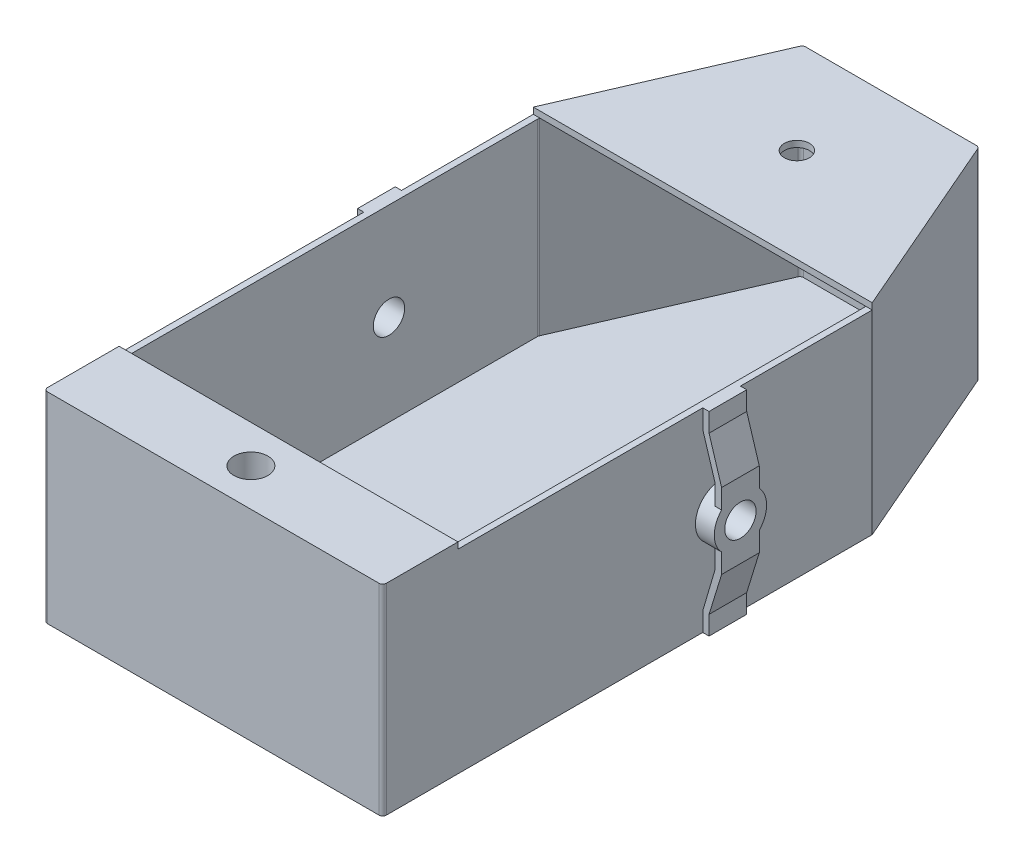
SolidWorks part; units mm, degrees
ref_plane "Front Plane" through (0, 0, 0) normal (0, 0, 1) x (1, 0, 0)
ref_plane "Top Plane" through (0, 0, 0) normal (0, 1, 0) x (1, 0, 0)
ref_plane "Right Plane" through (0, 0, 0) normal (1, 0, 0) x (0, 0, -1)
sketch "Sketch1" plane through (0, 0, 0) normal (0, 1, 0) x (1, 0, 0)
  line L0 (-135, 270) -> (-135, 120) construction
  line L1 (135, -270) -> (-135, -270)
  line L2 (135, -270) -> (135, 120)
  line L3 (70, 270) -> (-70, 270)
  line L4 (-135, -270) -> (-135, 120)
  line L5 (135, -270) -> (-135, 270) construction
  line L6 (135, 270) -> (-135, -270) construction
  line L7 (-135, 120) -> (135, 120) construction
  line L8 (-135, 120) -> (-70, 270)
  line L9 (135, 120) -> (70, 270)
  point P0 (0, 0)
  dimension "D1" = 540
  dimension "D2" = 270
  dimension "D3" = 150
  dimension "D4" = 65
  dimension "D5" = 65
extrude "Boss-Extrude5" add sketch "Sketch1" along normal blind 5
sketch "Sketch3" plane through (0, 5, 0) normal (0, 1, 0) x (1, 0, 0)
  line L0 (-70, 270) -> (-135, 120) construction
  line L1 (-135, 120) -> (-135, -270) construction
  line L2 (-135, -270) -> (135, -270) construction
  line L3 (135, -270) -> (135, 120) construction
  line L4 (135, 120) -> (70, 270) construction
  line L5 (70, 270) -> (-70, 270) construction
  line L6 (-70, 270) -> (-135, 120)
  line L7 (-135, 120) -> (-135, -270)
  line L8 (-135, -270) -> (135, -270)
  line L9 (135, -270) -> (135, 120)
  line L10 (135, 120) -> (70, 270)
  line L11 (70, 270) -> (-70, 270)
  line L12 (66.7174, 265) -> (-66.7174, 265)
  line L13 (-66.7174, 265) -> (-130, 118.9632)
  line L14 (-130, 118.9632) -> (-130, -265)
  line L15 (-130, -265) -> (130, -265)
  line L16 (130, -265) -> (130, 118.9632)
  line L17 (130, 118.9632) -> (66.7174, 265)
  dimension "D1" = 5
extrude "Boss-Extrude6" add sketch "Sketch3" along normal blind 150
sketch "Sketch4" plane through (0, 155, 0) normal (0, 1, 0) x (1, 0, 0)
  line L0 (135, 120) -> (70, 270) construction
  line L1 (-70, 270) -> (-135, 120) construction
  line L2 (70, 270) -> (-70, 270) construction
  line L3 (135, 120) -> (70, 270)
  line L4 (-70, 270) -> (-135, 120)
  line L5 (70, 270) -> (-70, 270)
  line L6 (-135, 120) -> (135, 120)
extrude "Boss-Extrude7" add sketch "Sketch4" along normal blind 5
sketch "Sketch5" plane through (0, 160, 0) normal (0, 1, 0) x (1, 0, 0)
  line L0 (0, 270) -> (0, 120) construction
  line L1 (70, 270) -> (-70, 270) construction
  line L2 (-135, 120) -> (135, 120) construction
  circle A0 centre (0, 195) radius 10
extrude "Cut-Extrude1" cut sketch "Sketch5" against normal blind 5
sketch "Sketch6" plane through (135, 0, 0) normal (1, 0, 0) x (0, 0, -1)
  line L0 (0, 0) -> (0, 155) construction
  line L1 (-270, 155) -> (120, 155) construction
  line L2 (0, 77.5) -> (45.0166, 77.5) construction
  line L3 (0, 0) -> (15, 0)
  line L4 (-270, 0) -> (120, 0) construction
  line L5 (15, 0) -> (15, 15)
  line L6 (15, 15) -> (-15, 15)
  line L7 (-15, 15) -> (-15, 0)
  line L8 (-15, 0) -> (0, 0)
  line L9 (-15, 140) -> (-15, 155)
  line L10 (-15, 155) -> (0, 155)
  line L11 (0, 155) -> (15, 155)
  line L12 (15, 155) -> (15, 140)
  line L13 (15, 140) -> (-15, 140)
extrude "Boss-Extrude9" add sketch "Sketch6" along normal blind 5
sketch "Sketch7" plane through (0, 0, 15) normal (0, 0, 1) x (1, 0, 0)
  line L0 (140, 15) -> (140, 140) construction
  line L1 (140, 77.5) -> (150, 77.5) construction
  line L2 (150, 47.5) -> (150, 107.5)
  line L3 (150, 107.5) -> (140, 140)
  line L4 (150, 47.5) -> (140, 15)
  line L5 (135, 140) -> (144.5676, 108.9054)
  line L6 (144.5676, 108.9054) -> (144.5676, 47.5)
  line L7 (144.5676, 47.5) -> (135, 15)
  line L8 (135, 140) -> (140, 140)
  line L9 (135, 15) -> (140, 15)
  point P9 (150, 77.5)
extrude "Boss-Extrude10" add sketch "Sketch7" against normal blind 30
sketch "Sketch8" plane through (150, 0, 0) normal (1, 0, 0) x (0, 0, -1)
  circle A0 centre (0, 77.5) radius 20.8446
extrude "Boss-Extrude11" add sketch "Sketch8" against normal up to body
mirror "Mirror1" about plane through (0, 0, 0) normal (1, 0, 0) of "Boss-Extrude11", "Boss-Extrude10", "Boss-Extrude9"
sketch "Sketch9" plane through (150, 0, 0) normal (1, 0, 0) x (0, 0, -1)
  circle A0 centre (0, 77.5) radius 12.5
extrude "Cut-Extrude2" cut sketch "Sketch9" against normal through all
sketch "Sketch10" plane through (0, 155, 0) normal (0, 1, 0) x (1, 0, 0)
  line L0 (135, -270) -> (135, -15) construction
  line L1 (-135, -270) -> (135, -270)
  line L2 (-135, -270) -> (-135, -210)
  line L3 (-135, -210) -> (135, -210)
  line L4 (135, -270) -> (135, -210)
  line L5 (-135, -270) -> (135, -210) construction
  line L6 (-135, -210) -> (135, -270) construction
  point P4 (0, -240)
extrude "Boss-Extrude12" add sketch "Sketch10" along normal blind 5
sketch "Sketch11" plane through (0, 160, 0) normal (0, 1, 0) x (1, 0, 0)
  line L0 (0, -210) -> (0, -270) construction
  line L1 (135, -210) -> (-135, -210) construction
  line L2 (-135, -270) -> (135, -270) construction
  circle A0 centre (0, -240) radius 13.5
extrude "Cut-Extrude4" cut sketch "Sketch11" against normal blind 5
sketch "Sketch12" plane through (0, 160, 0) normal (0, 1, 0) x (1, 0, 0)
  line L1 (29.8949, -260) -> (-29.8949, -260)
  line L2 (29.8949, -260) -> (29.8949, -220)
  line L3 (29.8949, -220) -> (-29.8949, -220)
  line L4 (-29.8949, -260) -> (-29.8949, -220)
  line L5 (29.8949, -260) -> (-29.8949, -220) construction
  line L6 (29.8949, -220) -> (-29.8949, -260) construction
  point P0 (0, -240)
  dimension "D1" = 40
extrude "Boss-Extrude13" add sketch "Sketch12" against normal blind 30
sketch "Sketch13" plane through (0, 160, 0) normal (0, 1, 0) x (1, 0, 0)
  line L0 (0, -270) -> (0, -210) construction
  line L1 (-135, -270) -> (135, -270) construction
  line L2 (135, -210) -> (-135, -210) construction
  circle A0 centre (0, -240) radius 13.5
extrude "Cut-Extrude5" cut sketch "Sketch13" against normal blind 30
fillet "Fillet1" radius 3 10 edges at (135, 80, 270) (-135, 80, 270) (66.7174, 80, -265) (-66.7174, 80, -265) (70, 80, -270) (-70, 80, -270) (130, 80, 265) (-130, 80, 265) (130, 80, -118.9632) (-130, 80, -118.9632)
